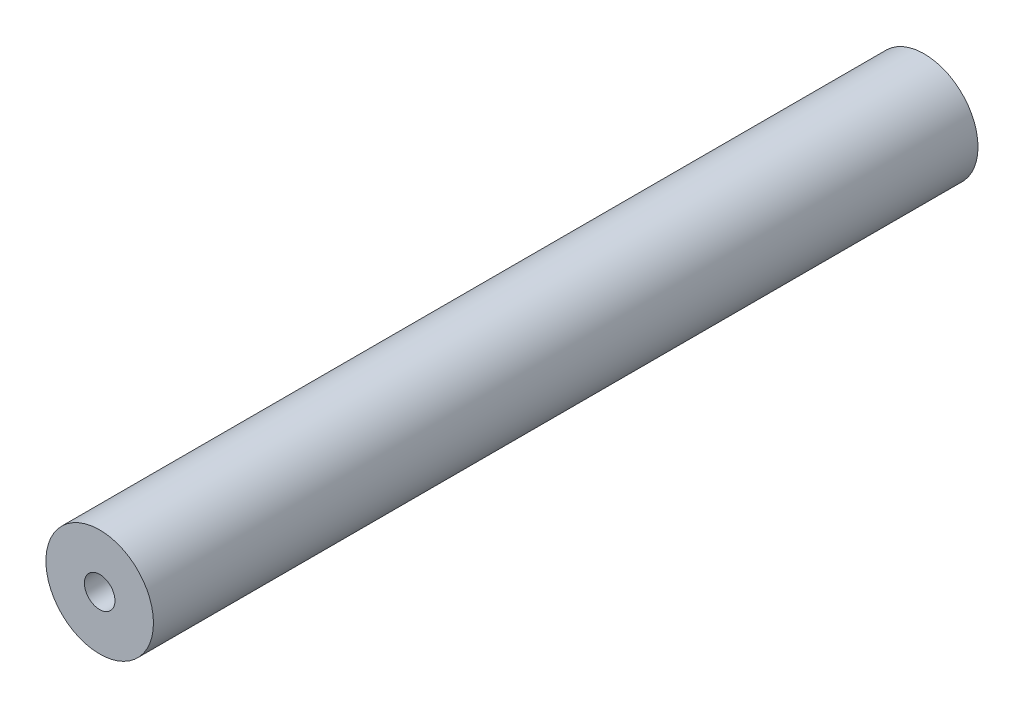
SolidWorks part; units mm, degrees
ref_plane "Front" through (0, 0, 0) normal (0, 0, 1) x (1, 0, 0)
ref_plane "Top" through (0, 0, 0) normal (0, 1, 0) x (1, 0, 0)
ref_plane "Right" through (0, 0, 0) normal (1, 0, 0) x (0, 0, -1)
sketch "Sketch1" plane through (0, 0, 0) normal (0, 0, 1) x (1, 0, 0)
  circle A0 centre (0, 0) radius 9.525
  dimension "D1" = 19.05
extrude "Boss-Extrude1" add sketch "Sketch1" along normal mid plane 146.05 contours A0
hole_wizard "1/4-28 Tapped Hole1" positions "Sketch2" profile "Sketch3" tap size "1/4-28" standard "ANSI Inch"
sketch "Sketch2" plane through (0, 0, 73.025) normal (0, 0, 1) x (1, 0, 0)
  point P0 (0, 0)
sketch "Sketch3" plane through (0, 0, 73.025) normal (1, 0, 0) x (0, -1, 0)
  line L0 (0, 0) -> (0, 25.222)
  line L1 (0, 25.222) -> (2.7051, 23.5966)
  line L2 (2.7051, 23.5966) -> (2.7051, 0)
  line L5 (2.7051, 0) -> (0, 0)
  line L10 (0, 25.222) -> (-2.7051, 23.5966) construction
  line L11 (0, -6.35) -> (0, 107.95) construction
  dimension "Tap Drill Dia." = 5.4102
  dimension "Tap Drill Depth" = 23.5966
  dimension "Drill Angle" = 118
hole_wizard "1/4-28 Tapped Hole2" positions "Sketch4" profile "Sketch5" tap size "1/4-28" standard "ANSI Inch"
sketch "Sketch4" plane through (0, 0, -73.025) normal (0, 0, -1) x (-1, 0, 0)
  point P0 (0, 0)
sketch "Sketch5" plane through (0, 0, -73.025) normal (1, 0, 0) x (0, 1, 0)
  line L0 (0, 0) -> (0, 25.222)
  line L1 (0, 25.222) -> (2.7051, 23.5966)
  line L2 (2.7051, 23.5966) -> (2.7051, 0)
  line L5 (2.7051, 0) -> (0, 0)
  line L10 (0, 25.222) -> (-2.7051, 23.5966) construction
  line L11 (0, -6.35) -> (0, 107.95) construction
  dimension "Tap Drill Dia." = 5.4102
  dimension "Tap Drill Depth" = 23.5966
  dimension "Drill Angle" = 118
